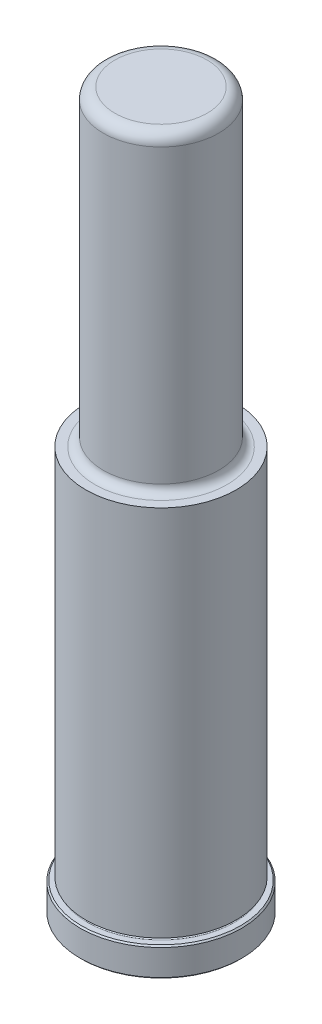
SolidWorks part; units mm, degrees
ref_plane "Front Plane" through (0, 0, 0) normal (0, 0, 1) x (1, 0, 0)
ref_plane "Top Plane" through (0, 0, 0) normal (0, 1, 0) x (1, 0, 0)
ref_plane "Right Plane" through (0, 0, 0) normal (1, 0, 0) x (0, 0, -1)
sketch "Sketch1" plane through (0, 0, 0) normal (1, 0, 0) x (0, 0, -1)
  line L0 (0, 0) -> (22.225, 0)
  line L1 (22.225, 0) -> (22.225, 7.9248)
  line L2 (22.225, 7.9248) -> (20.2438, 7.9248)
  line L3 (19.8628, 2.6782) -> (19.8628, 5.9795) construction
  line L4 (20.2438, 8.6868) -> (20.6502, 8.6868)
  line L5 (20.6502, 8.6868) -> (20.6502, 111.125)
  line L6 (20.6502, 111.125) -> (18.1483, 111.125)
  line L7 (15.8623, 113.411) -> (15.8623, 196.85)
  line L9 (15.8623, 196.85) -> (0, 196.85)
  line L10 (0, 196.85) -> (0, 0)
  line L11 (0, 0) -> (0, -7.2694) construction
  arc A0 (20.2438, 8.6868) -> (20.2438, 7.9248) centre (20.2438, 8.3058) ccw
  arc A1 (18.1483, 111.125) -> (15.8623, 113.411) centre (18.1483, 113.411) cw
  point P2 (15.8623, 196.85)
  point P14 (15.8623, 196.6411)
  point P19 (15.8623, 111.125)
  dimension "D14" = 0.762
  dimension "D8" = 2.286
  dimension "T" = 7.9248
  dimension "D2" = 0.762
  dimension "M" = 44.45
  dimension "B" = 41.3004
  dimension "L" = 196.85
  dimension "D7" = 0.7874
  dimension "A" = 111.125
  dimension "D" = 31.7246
  dimension "D15" = 85.725
revolve "Revolve1" add sketch "Sketch1" angle 360 about L11
chamfer "Chamfer1" distance 0.381 angle 45 2 edges at (0, 0, 22.225) (0, 7.9248, 22.225)
fillet "Fillet7" radius 3.175 1 edges at (0, 196.85, 15.8623)
